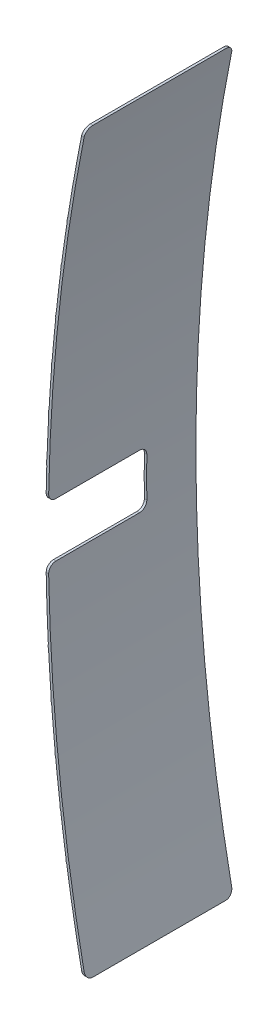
SolidWorks part; units mm, degrees
ref_plane "前视基准面" through (0, 0, 0) normal (0, 0, 1) x (1, 0, 0)
ref_plane "上视基准面" through (0, 0, 0) normal (0, 1, 0) x (1, 0, 0)
ref_plane "右视基准面" through (0, 0, 0) normal (1, 0, 0) x (0, 0, -1)
sketch "草图1" plane through (0, 0, 0) normal (0, 0, 1) x (1, 0, 0)
  line L0 (-73.5868, 15) -> (-73.4847, 15)
  line L1 (-73.5868, -15) -> (-73.4847, -15)
  line L2 (-1000, 0) -> (49000, 0) construction
  arc A0 (-73.5868, 15) -> (-73.5868, -15) centre (0, 0) ccw
  arc A1 (-73.4847, 15) -> (-73.4847, -15) centre (0, 0) ccw
  dimension "D1" = 150.2
  dimension "D2" = 150
  dimension "D3" = 30
extrude "凸台-拉伸1" add sketch "草图1" along normal blind 6
ref_plane "基准面1" through (-50, 0, 0) normal (1, 0, 0) x (0, 0, -1)
sketch "草图4" plane through (0, 0, 0) normal (1, 0, 0) x (0, 0, -1)
  line L0 (-6, -1.1) -> (-2, -1.1)
  line L1 (-6, 15) -> (-6, -15) construction
  line L2 (-2, -1.1) -> (-2, 1.1)
  line L3 (-2, 1.1) -> (-6, 1.1)
  line L4 (-6, 1.1) -> (-6, -1.1)
  line L5 (-1000, 0) -> (49000, 0) construction
  dimension "D1" = 4
  dimension "D2" = 2.2
extrude "切除-拉伸1" cut sketch "草图4" against normal through all
fillet "圆角1" radius 0.3 8 edges at (-73.5357, -15, 6) (-73.5357, -15, 0) (-73.5357, 15, 6) (-73.5357, 15, 0) (-75.0419, -1.1, 2) (-75.0419, 1.1, 2) (-75.0419, 1.1, 6) (-75.0419, -1.1, 6)
sketch "草图5" plane through (-50, 0, 0) normal (1, 0, 0) x (0, 0, -1)
  line L0 (0, -2.8572) -> (0, 3.1428)
  line L1 (0, 3.1428) -> (-2, 0.1428)
  line L2 (-2, 0.1428) -> (0, -2.8572)
  line L3 (-1002, 0.1428) -> (48998, 0.1428) construction
  line L4 (0, -14.7) -> (0, 14.7) construction
  line L5 (-2, 0.8) -> (-2, -0.8) construction
  line L6 (-6, -1.4) -> (-6, -14.7) construction
  line L7 (-6, -2.3) -> (-2, -2.3)
  line L8 (-6, -2.3) -> (-6, -2.1)
  line L9 (-6, -2.1) -> (-2, -2.1)
  line L10 (-2, -2.3) -> (-2, -2.1)
  line L31 (-5.7, -1.1) -> (-2.3, -1.1) construction
  line L56 (-6, -4.1) -> (-2, -4.1)
  line L57 (-6, -4.1) -> (-6, -3.9)
  line L58 (-6, -3.9) -> (-2, -3.9)
  line L59 (-2, -4.1) -> (-2, -3.9)
  line L60 (-6, -5.9) -> (-2, -5.9)
  line L61 (-6, -5.9) -> (-6, -5.7)
  line L62 (-6, -5.7) -> (-2, -5.7)
  line L63 (-2, -5.9) -> (-2, -5.7)
  line L64 (-6, -7.7) -> (-2, -7.7)
  line L65 (-6, -7.7) -> (-6, -7.5)
  line L66 (-6, -7.5) -> (-2, -7.5)
  line L67 (-2, -7.7) -> (-2, -7.5)
  line L68 (-6, -9.5) -> (-2, -9.5)
  line L69 (-6, -9.5) -> (-6, -9.3)
  line L70 (-6, -9.3) -> (-2, -9.3)
  line L71 (-2, -9.5) -> (-2, -9.3)
  line L72 (-6, -11.3) -> (-2, -11.3)
  line L73 (-6, -11.3) -> (-6, -11.1)
  line L74 (-6, -11.1) -> (-2, -11.1)
  line L75 (-2, -11.3) -> (-2, -11.1)
  line L76 (-6, -2.3) -> (-6, -4.1) construction
  line L77 (-6, 2.5855) -> (-6, 4.3855) construction
  line L78 (-2, 11.5855) -> (-2, 11.3855)
  line L79 (-6, 11.3855) -> (-2, 11.3855)
  line L80 (-6, 11.5855) -> (-6, 11.3855)
  line L81 (-6, 11.5855) -> (-2, 11.5855)
  line L82 (-2, 9.7855) -> (-2, 9.5855)
  line L83 (-6, 9.5855) -> (-2, 9.5855)
  line L84 (-6, 9.7855) -> (-6, 9.5855)
  line L85 (-6, 9.7855) -> (-2, 9.7855)
  line L86 (-2, 7.9855) -> (-2, 7.7855)
  line L87 (-6, 7.7855) -> (-2, 7.7855)
  line L88 (-6, 7.9855) -> (-6, 7.7855)
  line L89 (-6, 7.9855) -> (-2, 7.9855)
  line L90 (-2, 6.1855) -> (-2, 5.9855)
  line L91 (-6, 5.9855) -> (-2, 5.9855)
  line L92 (-6, 6.1855) -> (-6, 5.9855)
  line L93 (-6, 6.1855) -> (-2, 6.1855)
  line L94 (-2, 4.3855) -> (-2, 4.1855)
  line L95 (-6, 4.1855) -> (-2, 4.1855)
  line L96 (-6, 4.3855) -> (-6, 4.1855)
  line L97 (-6, 4.3855) -> (-2, 4.3855)
  line L98 (-2, 2.5855) -> (-2, 2.3855)
  line L99 (-6, 2.3855) -> (-2, 2.3855)
  line L100 (-6, 2.5855) -> (-6, 2.3855)
  line L101 (-6, 2.5855) -> (-2, 2.5855)
  line L116 (-5.7, 15) -> (-0.3, 15) construction
  line L117 (-4.8, 13.5) -> (-3.65, 13.5)
  line L118 (-4.8, 13.5) -> (-4.8, 13.3)
  line L119 (-4.8, 13.3) -> (-3.65, 13.3)
  line L120 (-2.3, 13.5) -> (-2.3, 13.3)
  line L121 (-6, 14.7) -> (-6, 1.4) construction
  line L122 (-3.65, 14.65) -> (-3.45, 14.65)
  line L123 (-3.65, 14.65) -> (-3.65, 13.5)
  line L124 (-3.65, 12.15) -> (-3.45, 12.15)
  line L125 (-3.45, 14.65) -> (-3.45, 13.5)
  line L126 (-5.7, -15) -> (-0.3, -15) construction
  line L127 (-3.65, -12.15) -> (-3.45, -12.15)
  line L128 (-3.65, -12.15) -> (-3.65, -14.65)
  line L129 (-3.65, -14.65) -> (-3.45, -14.65)
  line L130 (-3.45, -12.15) -> (-3.45, -14.65)
  line L131 (-3.45, 13.3) -> (-3.45, 12.15)
  line L132 (-3.45, 13.5) -> (-2.3, 13.5)
  line L133 (-3.65, 13.3) -> (-3.65, 12.15)
  line L134 (-3.45, 13.3) -> (-2.3, 13.3)
  point P81 (-3.65, -13.4)
  dimension "D1" = 6
  dimension "D2" = 0.2
  dimension "D3" = 6
  dimension "D5" = 1
  dimension "D4" = 1.8
  dimension "D6" = 2.5
  dimension "D7" = 0.2
  dimension "D8" = 1.5
  dimension "D9" = 2.5
  dimension "D10" = 0.2
  dimension "D11" = 1.15
  dimension "D12" = 1.15
  dimension "D13" = 1.2
  dimension "D14" = 2.5
  dimension "D15" = 0.2
  dimension "D16" = 0.35
  dimension "D17" = 2.35
wrap "包覆1" sketch "草图5" wrap type emboss source sketch "草图5" thickness 0.01 parameters "D1"=0.01
